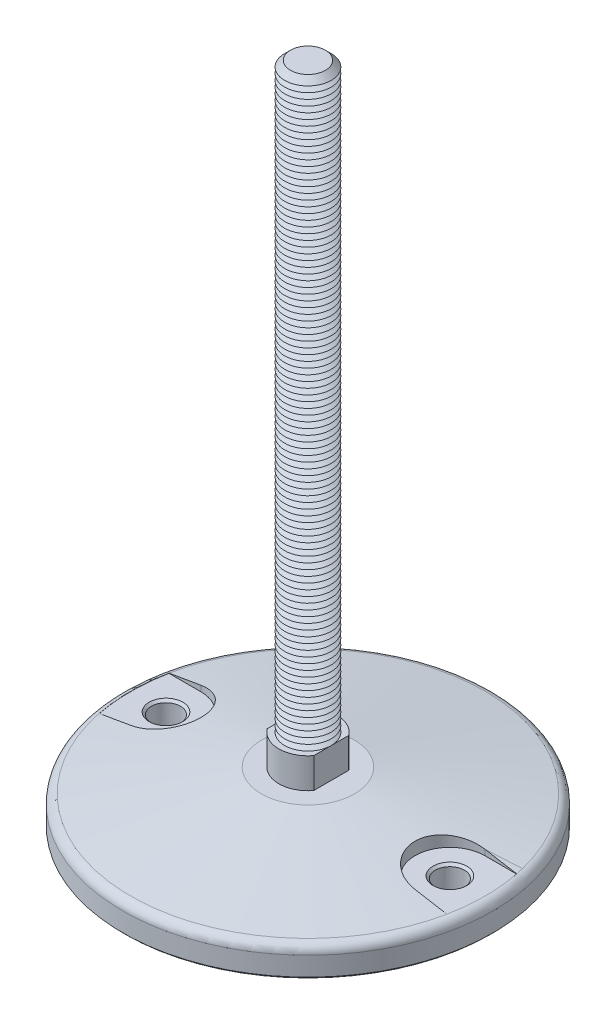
SolidWorks part; units mm, degrees
ref_plane "Front Plane" through (0, 0, 0) normal (0, 0, 1) x (1, 0, 0)
ref_plane "Top Plane" through (0, 0, 0) normal (0, 1, 0) x (1, 0, 0)
ref_plane "Right Plane" through (0, 0, 0) normal (1, 0, 0) x (0, 0, -1)
sketch "Sketch1" plane through (0, 0, 0) normal (1, 0, 0) x (0, 0, -1)
  line L0 (0, 61.3389) -> (0, -58.404) construction
sketch "Sketch2" plane through (0, 0, 0) normal (1, 0, 0) x (0, 0, -1)
  line L0 (0, 0) -> (-20, 0)
  line L1 (-20, 0) -> (-79.5, -10.4915)
  line L2 (-79.5, -10.4915) -> (-79.5, -23)
  line L3 (-79.5, -23) -> (0, -23)
  line L4 (0, 61.3389) -> (0, -58.404) construction
  line L5 (0, -23) -> (0, 0)
  dimension "D1" = 23
  dimension "D2" = 79.5
  dimension "D3" = 20
  dimension "D4" = 10
revolve "Revolve1" add sketch "Sketch2" angle 360 about L0
fillet "Fillet1" radius 4 1 edges at (0, -10.4915, 79.5)
sketch "Sketch3" plane through (0, 0, 0) normal (0, 1, 0) x (1, 0, 0)
  circle A0 centre (0, 0) radius 12.5
  dimension "D1" = 25
extrude "Boss-Extrude1" add sketch "Sketch3" along normal blind 13
sketch "Sketch4" plane through (0, 13, 0) normal (0, 1, 0) x (1, 0, 0)
  line L0 (-10, 7.5) -> (-10, -7.5)
  line L2 (10, -7.5) -> (10, 7.5)
  arc A0 (-10, 7.5) -> (-10, -7.5) centre (0, 0) ccw
  circle A1 centre (0, 0) radius 12.5 construction
  arc A2 (10, -7.5) -> (10, 7.5) centre (0, 0) ccw
  dimension "D1" = 20
extrude "Cut-Extrude1" cut sketch "Sketch4" against normal blind 13
sketch "Sketch5" plane through (0, 13, 0) normal (0, 1, 0) x (1, 0, 0)
  circle A0 centre (0, 0) radius 10
  dimension "D1" = 20
extrude "Boss-Extrude2" add sketch "Sketch5" along normal blind 250
chamfer "Chamfer1" distance 2.5 angle 45 1 edges at (0, 263, 10)
sketch "Sketch6" plane through (0, 0, 0) normal (1, 0, 0) x (0, 0, -1)
  line L0 (-10, 13) -> (-7.8349, 14.25)
  line L1 (-7.8349, 14.25) -> (-10, 15.5)
  line L2 (-10, 260.5) -> (-10, 13) construction
  line L3 (-10, 15.5) -> (-10, 13)
  dimension "D1" = 2.5
revolve "Cut-Revolve1" cut sketch "Sketch6" angle 360 about L0
pattern_linear "LPattern1" count 99 spacing 2.5 along (0, 1, 0) of "Cut-Revolve1"
sketch "Sketch8" plane through (0, 0, 0) normal (0, 1, 0) x (1, 0, 0)
  line L0 (-61, 15) -> (-74.7035, 15)
  line L1 (-61, -15) -> (-74.7035, -15)
  arc A1 (-74.7035, 15) -> (-74.7035, -15) centre (0, 0) ccw
  circle A2 centre (0, 0) radius 76.1946 construction
  arc A3 (-61, -15) -> (-61, 15) centre (-61, 0) ccw
  point P3 (-61, 0)
  point P11 (0, 0)
  dimension "D1" = 61
  dimension "D2" = 30
extrude "Cut-Extrude4" cut sketch "Sketch8" against normal blind 10
sketch "Sketch10" plane through (0, -10, 0) normal (0, 1, 0) x (1, 0, 0)
  circle A0 centre (-61, 0) radius 6.25
  dimension "D1" = 12.5
extrude "Cut-Extrude5" cut sketch "Sketch10" against normal up to surface (13 mm away)
chamfer "Chamfer2" distance 1 angle 45 2 edges at (-61, -23, -6.25) (-61, -10, 6.25)
mirror "Mirror1" about plane through (0, 0, 0) normal (1, 0, 0) of "Chamfer2", "Cut-Extrude5", "Cut-Extrude4"
chamfer "Chamfer3" distance 1 angle 45 1 edges at (0, -23, 79.5)
